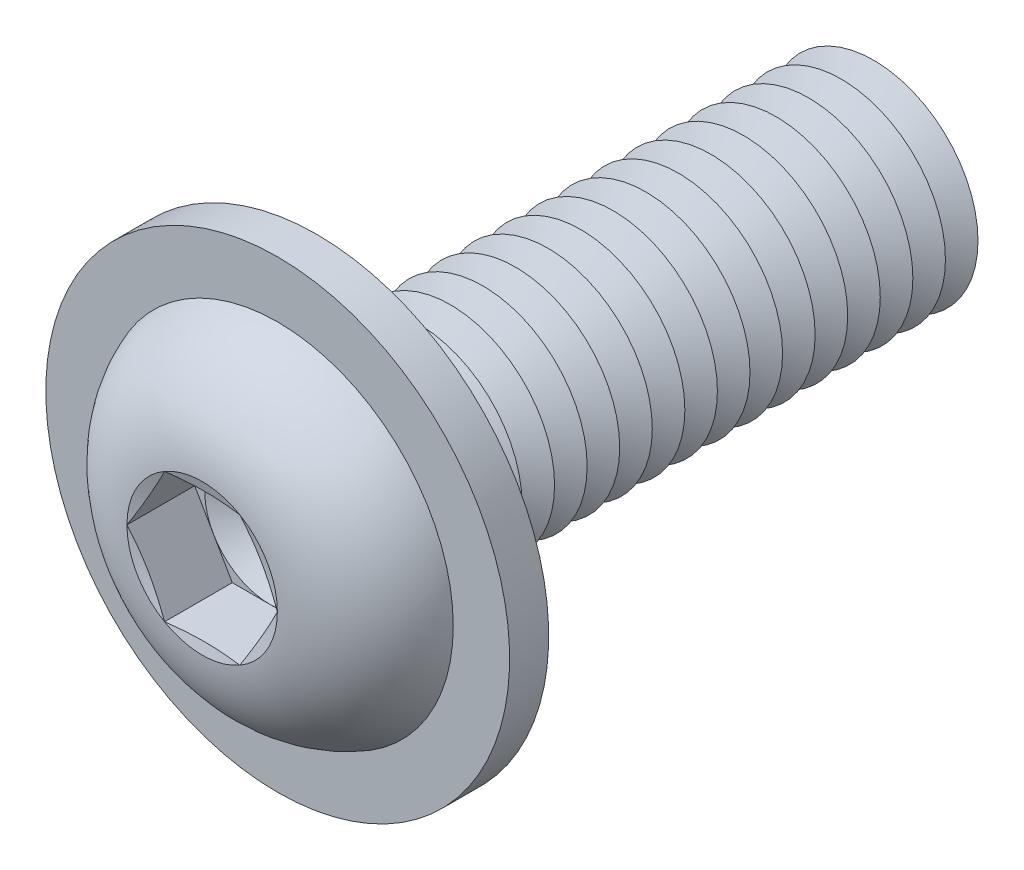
SolidWorks part; units mm, degrees
ref_plane "Front Plane" through (0, 0, 0) normal (0, 0, 1) x (1, 0, 0)
ref_plane "Top Plane" through (0, 0, 0) normal (0, 1, 0) x (1, 0, 0)
ref_plane "Right Plane" through (0, 0, 0) normal (1, 0, 0) x (0, 0, -1)
sketch "Sketch1" plane through (0, 0, 0) normal (1, 0, 0) x (0, 0, -1)
  line L0 (0, 4) -> (0, 7)
  line L3 (0, 4) -> (22, 4)
  line L4 (22, 4) -> (22, 0)
  line L5 (22, 0) -> (-4.4, 0) construction
  line L6 (-4.4, 0) -> (22, 0)
  line L7 (-4.4, 2.8867) -> (-4.4, 1.4434) construction
  line L8 (-4.4, 1.4434) -> (-4.4, 0)
  line L9 (-4.4, 2.8867) -> (-4.0132, 1.4434)
  line L10 (-4.0132, 1.4434) -> (-4.4, 1.4434)
  line L11 (22, 0) -> (22.7481, 0) construction
  line L12 (0, 7) -> (-4.4, 7) construction
  arc A1 (0, 7) -> (-4.4, 2.8867) centre (0, 2.59) ccw
  point P8 (22, 2)
  dimension "D1" = 14
  dimension "D2" = 8
  dimension "D3" = 4.4
  dimension "D4" = 5.7735
  dimension "D5" = 22
  dimension "D6" = 15
revolve "Revolve1" add sketch "Sketch1" angle 360 about L5
fillet "Fillet1" radius 0.625 1 edges at (-4, 0, 0)
sketch "Sketch2" plane through (0, 0, 0) normal (1, 0, 0) x (0, 0, -1)
  line L0 (21.375, 4) -> (22.625, 4)
  line L1 (22, 4) -> (0.625, 4) construction
  line L2 (22.625, 4) -> (22, 2.9175)
  line L3 (22, -4) -> (22, 4) construction
  line L4 (22, 2.9175) -> (21.375, 4)
  dimension "D1" = 1.25
revolve "Cut-Revolve1" cut sketch "Sketch2" angle 360 about axis through (0, 0, -22) along (0, 0, -1)
pattern_linear "LPattern1" count 17 spacing 1.25 along (0, 0, 1) of "Cut-Revolve1"
sketch "Sketch3" plane through (0, 0, 4.4) normal (0, 0, 1) x (1, 0, 0)
  line L7 (1.4434, 2.5) -> (-1.4434, 2.5)
  line L8 (-1.4434, 2.5) -> (-2.8867, 0)
  line L9 (-2.8867, 0) -> (-1.4434, -2.5)
  line L10 (-1.4434, -2.5) -> (1.4434, -2.5)
  line L11 (1.4434, -2.5) -> (2.8867, 0)
  line L12 (2.8867, 0) -> (1.4434, 2.5)
  circle A0 centre (0, 0) radius 2.5 construction
  circle A3 centre (0, 0) radius 2.8867 construction
extrude "Cut-Extrude1" cut sketch "Sketch3" against normal blind 2.6
sketch "Sketch4" plane through (0, 0, 1.8) normal (0, 0, 1) x (1, 0, 0)
  line L1 (1.4434, 2.5) -> (-1.4434, 2.5) construction
  circle A0 centre (0, 0) radius 2.5
extrude "Cut-Extrude2" cut sketch "Sketch4" against normal through all draft 60
sketch "Sketch5" plane through (0, 0, 0) normal (0, 0, -1) x (-1, 0, 0)
  circle A0 centre (0, 0) radius 8.9
  circle A1 centre (0, 0) radius 4.625
  circle A2 centre (0, 0) radius 4.625 construction
  dimension "D1" = 17.8
extrude "Boss-Extrude1" add sketch "Sketch5" against normal blind 1.5
